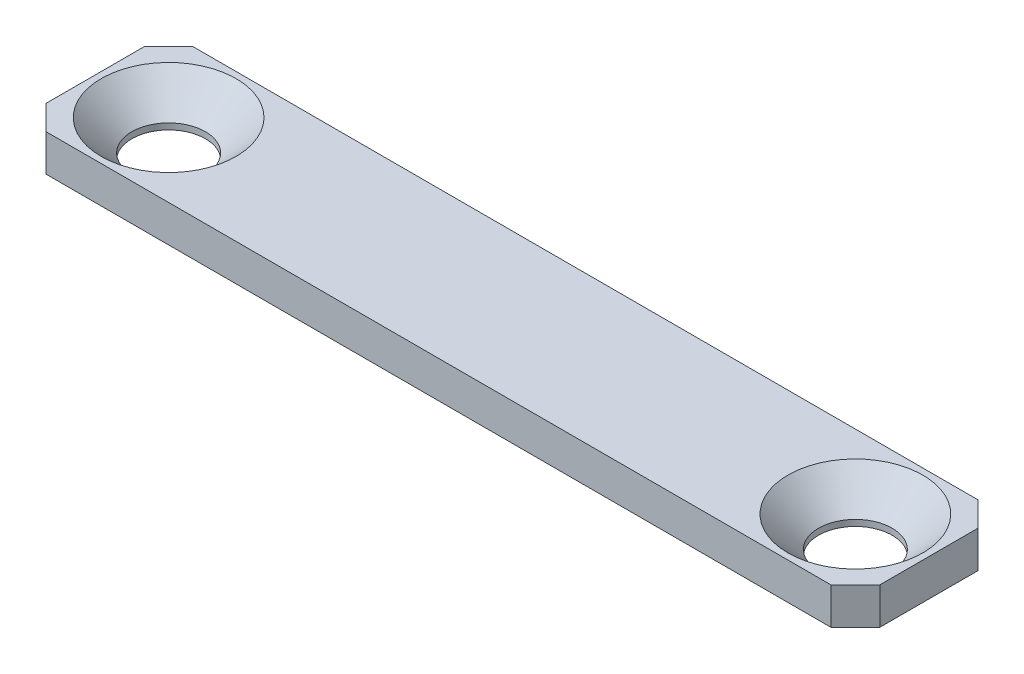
SolidWorks part; units mm, degrees
ref_plane "Спереди" through (0, 0, 0) normal (0, 0, 1) x (1, 0, 0)
ref_plane "Сверху" through (0, 0, 0) normal (0, 1, 0) x (1, 0, 0)
ref_plane "Справа" through (0, 0, 0) normal (1, 0, 0) x (0, 0, -1)
sketch "Эскиз1" plane through (0, 0, 0) normal (0, 1, 0) x (1, 0, 0)
  line L1 (0, 0) -> (34, 0)
  line L2 (0, 0) -> (0, 6)
  line L3 (0, 6) -> (34, 6)
  line L4 (34, 0) -> (34, 6)
  dimension "D1" = 6
  dimension "D2" = 34
extrude "Бобышка-Вытянуть1" add sketch "Эскиз1" along normal blind 1.5
hole_wizard "Зенковка для винта с полупотайной головкой M2.51" positions "Эскиз3" profile "Эскиз2" countersink size "M2.5" standard "ISO"
sketch "Эскиз3" plane through (0, 1.5, 0) normal (0, 1, 0) x (-1, 0, 0)
  line L0 (0, -3) -> (-34, -3) construction
  line L1 (0, -6) -> (0, 0) construction
  line L2 (-34, 0) -> (-34, -6) construction
  line L4 (-17, -6) -> (-17, 1.8998) construction
  line L5 (-34, -6) -> (0, -6) construction
  point P0 (-3, -3)
  point P18 (-31, -3)
  dimension "D1" = 28
sketch "Эскиз2" plane through (3, 1.5, -3) normal (1, 0, 0) x (0, 0, 1)
  line L0 (0, 0) -> (0, 1.5)
  line L1 (0, 1.5) -> (1.5, 1.5)
  line L2 (1.5, 1.5) -> (1.5, 1.25)
  line L3 (1.5, 1.25) -> (2.75, 0)
  line L5 (2.75, 0) -> (0, 0)
  line L6 (-1.5, 1.25) -> (-2.75, 0) construction
  line L11 (0, -6.35) -> (0, 107.95) construction
  dimension "Диаметр сквозного отверстия" = 3
  dimension "Глубина сквозного отверстия" = 1.5
  dimension "Диаметр передней зенковки" = 5.5
  dimension "Угол передней зенковки" = 90
chamfer "Фаска2" distance 1 angle 45 4 edges at (34, 0.75, 0) (34, 0.75, -6) (0, 0.75, -6) (0, 0.75, 0)
